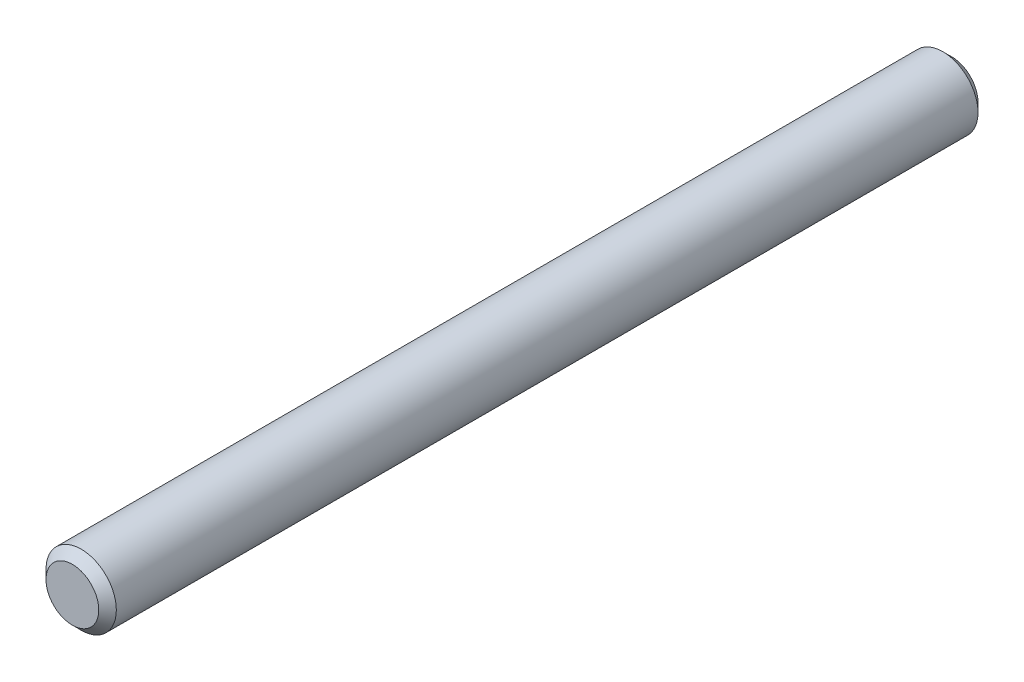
SolidWorks part; units mm, degrees
ref_plane "前视基准面" through (0, 0, 0) normal (0, 0, 1) x (1, 0, 0)
ref_plane "上视基准面" through (0, 0, 0) normal (0, 1, 0) x (1, 0, 0)
ref_plane "右视基准面" through (0, 0, 0) normal (1, 0, 0) x (0, 0, -1)
sketch "草图1" plane through (0, 0, 0) normal (0, 0, 1) x (1, 0, 0)
  circle A0 centre (0, 0) radius 2
extrude "凸台-拉伸1" add sketch "草图1" against normal blind 50
chamfer "倒角1" distance 0.5 angle 45 2 edges at (2, 0, -50) (2, 0, 0)
